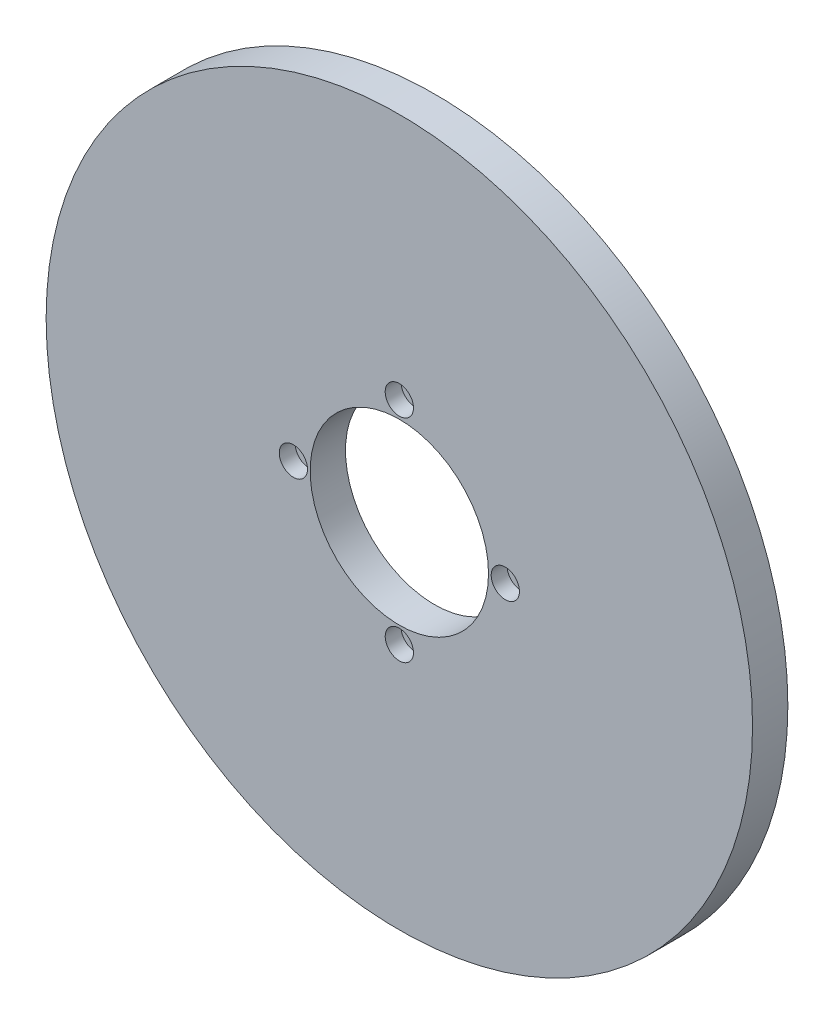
SolidWorks part; units mm, degrees
ref_plane "前视基准面" through (0, 0, 0) normal (0, 0, 1) x (1, 0, 0)
ref_plane "上视基准面" through (0, 0, 0) normal (0, 1, 0) x (1, 0, 0)
ref_plane "右视基准面" through (0, 0, 0) normal (1, 0, 0) x (0, 0, -1)
sketch "草图1" plane through (0, 0, 0) normal (0, 0, 1) x (1, 0, 0)
  circle A0 centre (0, 0) radius 100
  circle A1 centre (0, 0) radius 25.25
  circle A2 centre (30, 0) radius 2.25
  circle A3 centre (0, 30) radius 2.25
  circle A4 centre (-30, 0) radius 2.25
  circle A5 centre (0, -30) radius 2.25
extrude "凸台-拉伸1" add sketch "草图1" along normal blind 10
sketch "草图2" plane through (0, 0, 10) normal (0, 0, 1) x (1, 0, 0)
  circle A0 centre (30, 0) radius 4
  circle A1 centre (0, 30) radius 4
  circle A2 centre (-30, 0) radius 4
  circle A3 centre (0, -30) radius 4
extrude "切除-拉伸1" cut sketch "草图2" against normal blind 4.5
